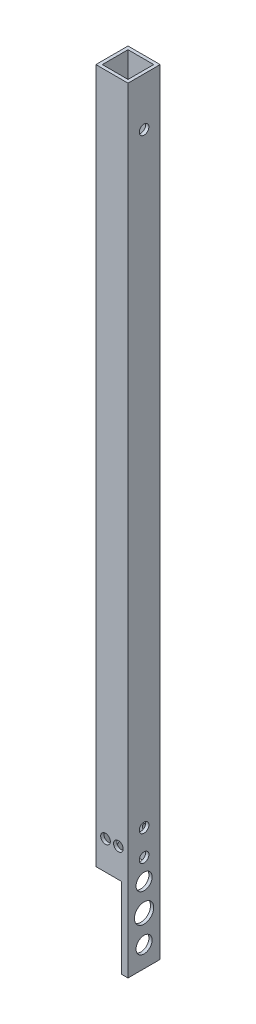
SolidWorks part; units mm, degrees
ref_plane "Front" through (0, 0, 0) normal (0, 0, 1) x (1, 0, 0)
ref_plane "Top" through (0, 0, 0) normal (0, 1, 0) x (1, 0, 0)
ref_plane "Right" through (0, 0, 0) normal (1, 0, 0) x (0, 0, -1)
sketch "草图1" plane through (0, 0, 0) normal (0, 1, 0) x (1, 0, 0)
  line L1 (-5, -5) -> (5, -5)
  line L2 (-5, -5) -> (-5, 5)
  line L3 (-5, 5) -> (5, 5)
  line L4 (5, -5) -> (5, 5)
  line L5 (-5, -5) -> (5, 5) construction
  line L6 (-5, 5) -> (5, -5) construction
  line L7 (-4, -4) -> (4, -4)
  line L8 (-4, -4) -> (-4, 4)
  line L9 (-4, 4) -> (4, 4)
  line L10 (4, -4) -> (4, 4)
  line L11 (-4, -4) -> (4, 4) construction
  line L12 (-4, 4) -> (4, -4) construction
  point P1 (0, 0)
  point P6 (0, 0)
  dimension "D1" = 10
  dimension "D2" = 10
  dimension "D3" = 1
extrude "凸台-拉伸1" add sketch "草图1" along normal blind 241
sketch "草图3" plane through (5, 0, 0) normal (1, 0, 0) x (0, 0, -1)
  line L0 (-5, 241) -> (5, 241) construction
  line L2 (5, 241) -> (5, 0) construction
  circle A0 centre (0, 226) radius 1.5
  dimension "D1" = 15
  dimension "D2" = 3
  dimension "D3" = 5
extrude "切除-拉伸2" cut sketch "草图3" against normal up to surface (10 mm away)
sketch "草图4" plane through (0, 0, 5) normal (0, 0, 1) x (1, 0, 0)
  line L0 (-5, 241) -> (-5, 0) construction
  line L1 (-5, 0) -> (5, 0) construction
  circle A0 centre (0, 8) radius 1.5
  dimension "D1" = 5
  dimension "D2" = 8
  dimension "D3" = 3
extrude "切除-拉伸3" cut sketch "草图4" against normal up to surface (10 mm away)
sketch "草图5" plane through (-5, 0, 0) normal (-1, 0, 0) x (0, 0, 1)
  line L0 (5, 241) -> (5, 0) construction
  line L1 (-5, 0) -> (5, 0) construction
  circle A0 centre (0, 15) radius 3
  dimension "D1" = 5
  dimension "D2" = 15
  dimension "D3" = 6
extrude "切除-拉伸4" cut sketch "草图5" against normal up to surface (10 mm away)
sketch "草图6" plane through (5, 0, 0) normal (1, 0, 0) x (0, 0, -1)
  line L2 (-5, 241) -> (-5, 0) construction
  line L3 (-5, 0) -> (5, 0) construction
  circle A1 centre (0, 30) radius 1.5
  circle A3 centre (0, 38) radius 1.5
  dimension "D1" = 5
  dimension "D6" = 3
  dimension "D7" = 3
  dimension "D2" = 8
  dimension "D3" = 30
  dimension "D4" = 5
extrude "切除-拉伸5" cut sketch "草图6" against normal up to surface (10 mm away)
sketch "草图7" plane through (5, 0, 0) normal (1, 0, 0) x (0, 0, -1)
  circle A0 centre (0, 15) radius 3
  dimension "D1" = 6
sketch "草图8" plane through (-5, 0, 0) normal (-1, 0, 0) x (0, 0, 1)
  line L0 (-5, 241) -> (-5, 0) construction
  line L1 (-5, 25) -> (5, 25)
  line L2 (-5, 25) -> (-5, 0)
  line L3 (-5, 0) -> (5, 0)
  line L4 (5, 25) -> (5, 0)
  circle A0 centre (0, 15) radius 3 construction
  dimension "D1" = 10
extrude "切除-拉伸7" cut sketch "草图8" against normal blind 8
hole_wizard "Ø5.0 (5) 直径孔1" positions "草图9" profile "草图10" hole size "Ø5.0" standard "GB"
sketch "草图9" plane through (4, 0, 0) normal (-1, 0, 0) x (0, 0, 1)
  point P0 (0, 23.5)
  point P3 (0, 6.5)
sketch "草图10" plane through (4, 23.5, 0) normal (0, 1, 0) x (0, 0, 1)
  line L0 (0, 0) -> (0, 1)
  line L1 (0, 1) -> (2.5, 1)
  line L2 (2.5, 1) -> (2.5, 0)
  line L5 (2.5, 0) -> (0, 0)
  line L11 (0, -6.35) -> (0, 107.95) construction
  dimension "通孔孔直径" = 5
  dimension "通孔孔深度" = 1
hole_wizard "Ø3.0 (3) 直径孔1" positions "草图11" profile "草图12" hole size "Ø3.0" standard "GB"
sketch "草图11" plane through (0, 0, 5) normal (0, 0, 1) x (1, 0, 0)
  point P0 (2, 34)
  point P3 (-2, 34)
sketch "草图12" plane through (2, 34, 5) normal (1, 0, 0) x (0, -1, 0)
  line L0 (0, 0) -> (0, 10)
  line L1 (0, 10) -> (1.5, 10)
  line L2 (1.5, 10) -> (1.5, 0)
  line L5 (1.5, 0) -> (0, 0)
  line L11 (0, -6.35) -> (0, 107.95) construction
  dimension "通孔孔直径" = 3
  dimension "通孔孔深度" = 10
